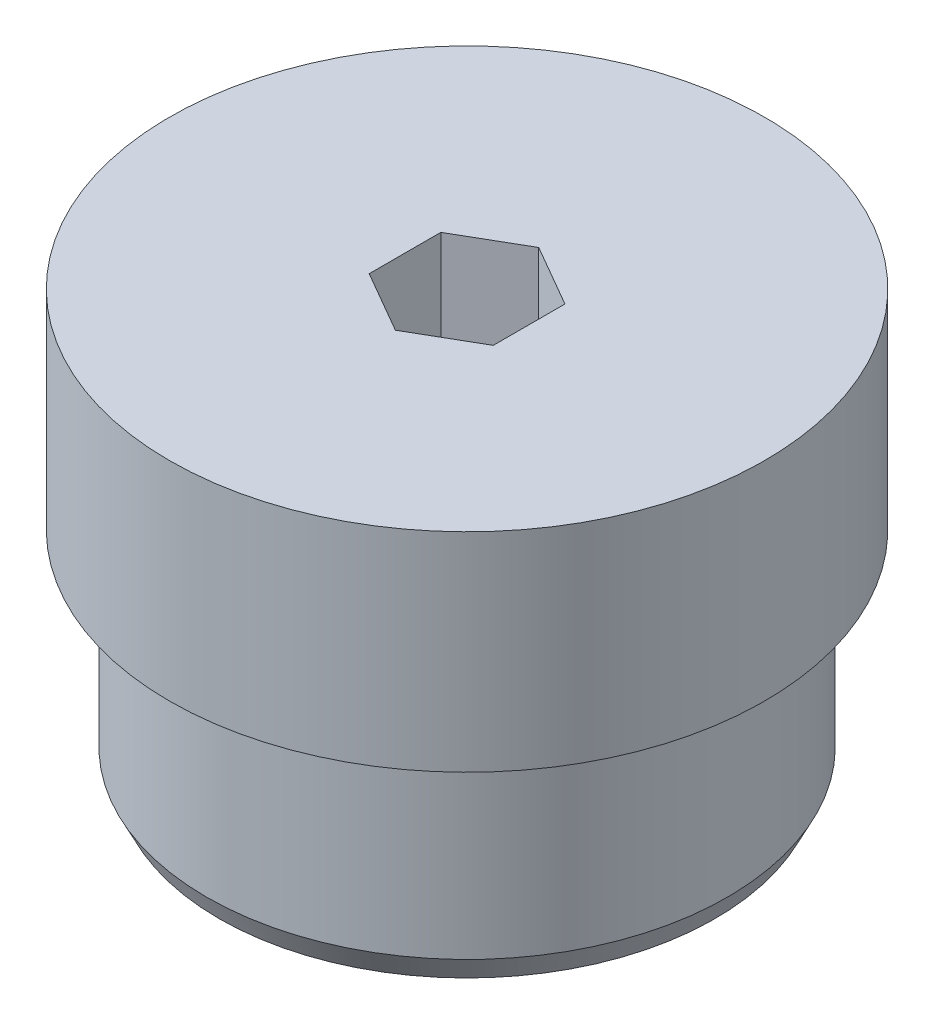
SolidWorks part; units mm, degrees
ref_plane "Plan1" through (0, 0, 0) normal (0, 0, 1) x (1, 0, 0)
ref_plane "Plan2" through (0, 0, 0) normal (0, 1, 0) x (1, 0, 0)
ref_plane "Plan3" through (0, 0, 0) normal (1, 0, 0) x (0, 0, -1)
sketch "Esquisse1" plane through (0, 0, 0) normal (0, 0, 1) x (1, 0, 0)
  line L0 (0, 30) -> (0, -30) construction
  line L1 (-4, 0) -> (-5, 0)
  line L2 (-5, 0) -> (-5.25, 0.5)
  line L3 (-5.25, 0.5) -> (-5.25, 4.3)
  line L4 (-5.25, 4.3) -> (-6, 4.3)
  line L5 (-6, 4.3) -> (-6, 8.5)
  line L6 (-6, 8.5) -> (0, 8.5)
  line L7 (-2, 3.1047) -> (-2, 5.7047)
  line L8 (-2, 3.1047) -> (-4, 1.95)
  line L9 (-4, 1.95) -> (-4, 0)
  line L10 (-2, 5.7047) -> (0, 5.7047)
  line L11 (0, 5.7047) -> (0, 8.5)
  dimension "D1" = 8
  dimension "D2" = 4
  dimension "D3" = 10.5
  dimension "D4" = 10
  dimension "D5" = 12
  dimension "D6" = 0.5
  dimension "D7" = 3.8
  dimension "D8" = 4.2
  dimension "D9" = 1.95
  dimension "D10" = 120
  dimension "D11" = 2.6
revolve "Base-Révolution" add sketch "Esquisse1" angle 360 about L0
sketch "Esquisse2" plane through (0, 8.5, 0) normal (0, 1, 0) x (-1, 0, 0)
  line L1 (0, 1.445) -> (-1.2514, 0.7225)
  line L2 (-1.2514, 0.7225) -> (-1.2514, -0.7225)
  line L3 (-1.2514, -0.7225) -> (0, -1.445)
  line L4 (0, -1.445) -> (1.2514, -0.7225)
  line L5 (1.2514, -0.7225) -> (1.2514, 0.7225)
  line L6 (1.2514, 0.7225) -> (0, 1.445)
  circle A0 centre (0, 0) radius 1.2514 construction
  dimension "D1" = 2.89
extrude "Enlèv. mat.-Extru.1" cut sketch "Esquisse2" against normal through all
